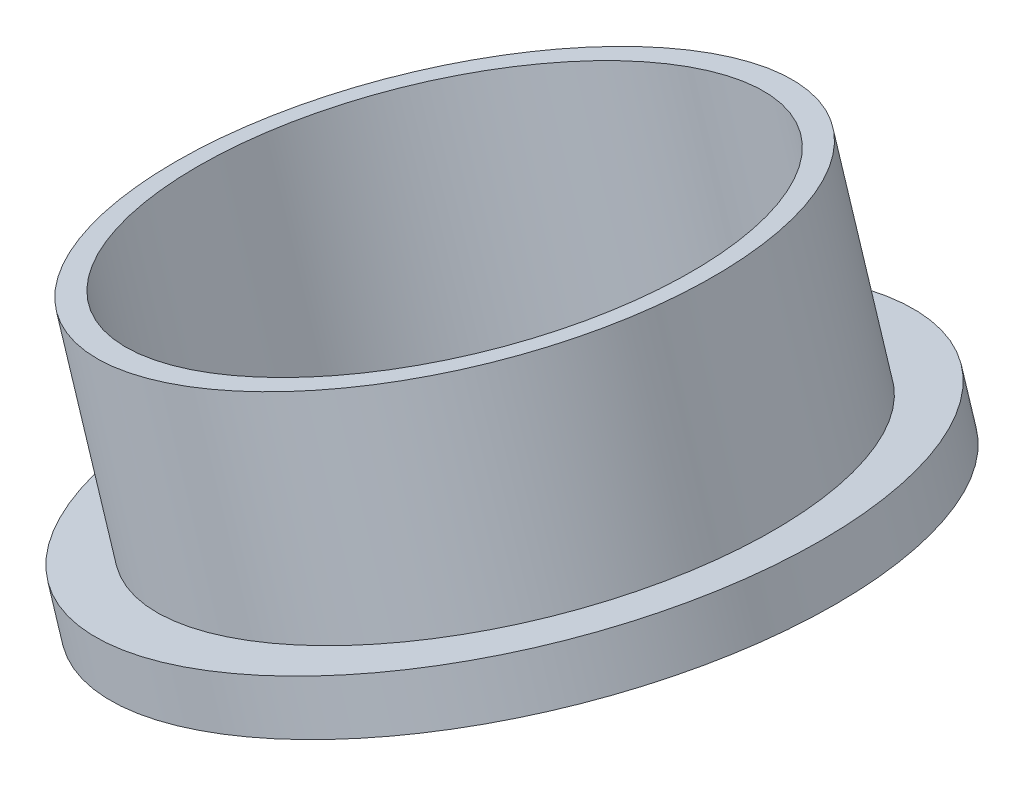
SolidWorks part; units mm, degrees
ref_plane "Alzado" through (0, 0, 0) normal (0, 0, 1) x (1, 0, 0)
ref_plane "Planta" through (0, 0, 0) normal (0, 1, 0) x (1, 0, 0)
ref_plane "Vista lateral" through (0, 0, 0) normal (1, 0, 0) x (0, 0, -1)
sketch "Sk_Cazoleta" plane through (0, 0, 0) normal (0, 0, 1) x (1, 0, 0)
  line L0 (420.6694, 409.5157) -> (422.0046, 409.9367)
  line L1 (422.0046, 409.9367) -> (425.6131, 398.4921)
  line L2 (425.6131, 398.4921) -> (428.4743, 399.3943)
  line L3 (428.4743, 399.3943) -> (429.3764, 396.5331)
  line L4 (429.3764, 396.5331) -> (425.1801, 395.21)
  line L5 (425.1801, 395.21) -> (420.6694, 409.5157)
  line L6 (404.2879, 409.5931) -> (414.8129, 376.2131) construction
revolve "Cazoleta" add sketch "Sk_Cazoleta" angle 360 about L6
